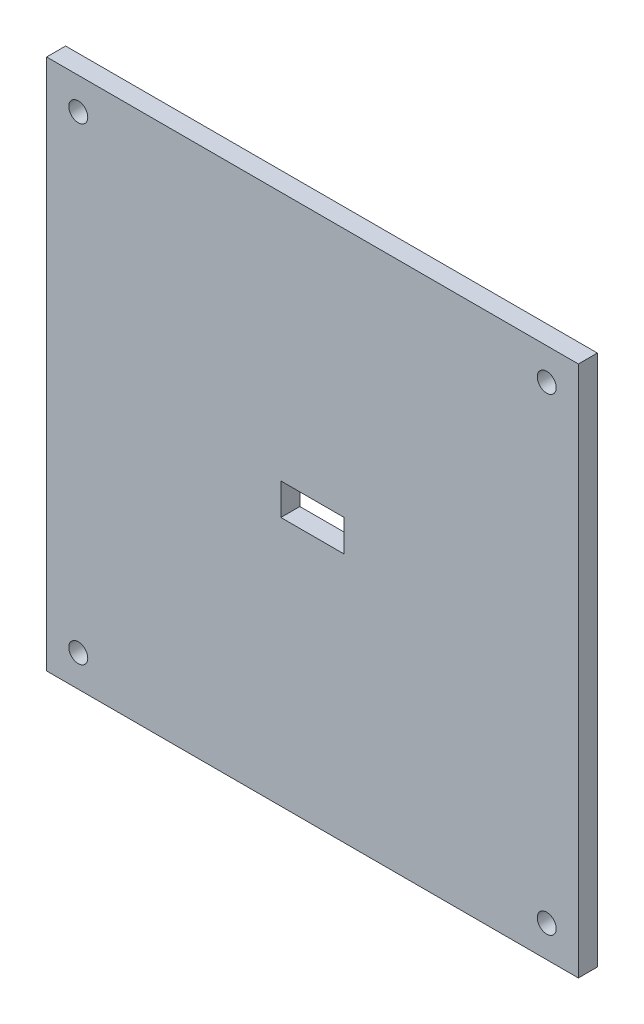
SolidWorks part; units mm, degrees
ref_plane "Piano frontale" through (0, 0, 0) normal (0, 0, 1) x (1, 0, 0)
ref_plane "Piano superiore" through (0, 0, 0) normal (0, 1, 0) x (1, 0, 0)
ref_plane "Piano destro" through (0, 0, 0) normal (1, 0, 0) x (0, 0, -1)
sketch "Sketch1" plane through (0, 0, 0) normal (0, 0, 1) x (1, 0, 0)
  line L1 (-42, 42) -> (42, 42)
  line L2 (-42, 42) -> (-42, -42)
  line L3 (-42, -42) -> (42, -42)
  line L4 (42, 42) -> (42, -42)
  line L5 (-42, 42) -> (42, -42) construction
  line L6 (-42, -42) -> (42, 42) construction
  line L7 (-5, 2.5) -> (5, 2.5)
  line L8 (-5, 2.5) -> (-5, -2.5)
  line L9 (-5, -2.5) -> (5, -2.5)
  line L10 (5, 2.5) -> (5, -2.5)
  line L11 (-5, 2.5) -> (5, -2.5) construction
  line L12 (-5, -2.5) -> (5, 2.5) construction
  circle A0 centre (-37, 37) radius 1.5
  circle A1 centre (37, 37) radius 1.5
  circle A2 centre (37, -37) radius 1.5
  circle A3 centre (-37, -37) radius 1.5
  point P0 (0, 0)
  point P6 (0, 0)
  point P22 (0, 0)
  dimension "D6" = 3
  dimension "D1" = 84
  dimension "D2" = 84
  dimension "D3" = 10
  dimension "D4" = 5
  dimension "D5" = 5
  dimension "D7" = 4
extrude "Boss-Extrude1" add sketch "Sketch1" along normal blind 3
